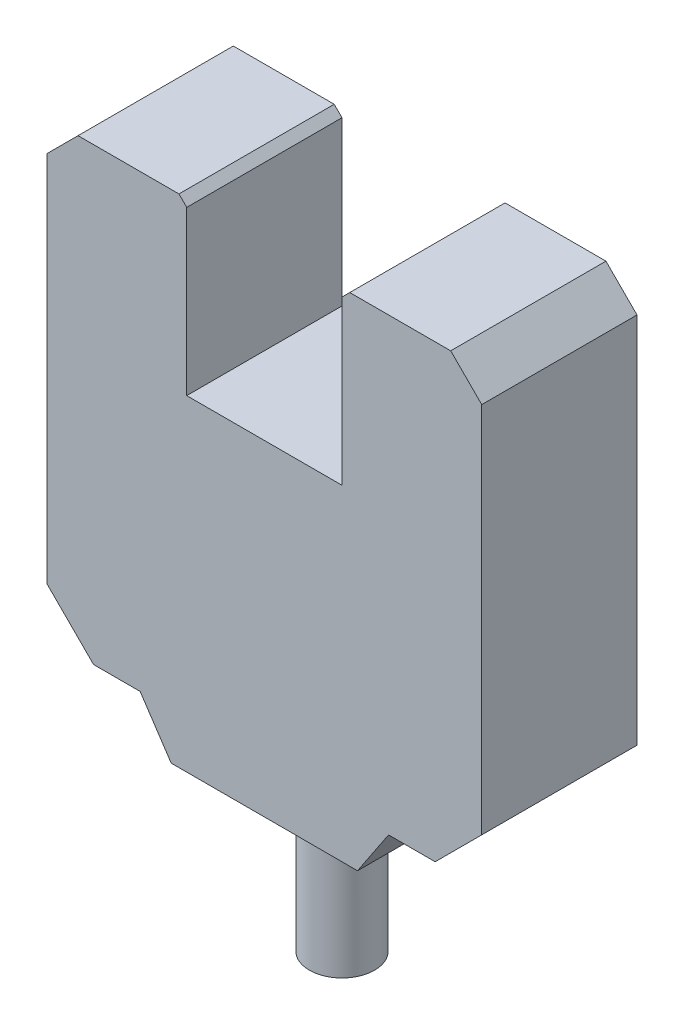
SolidWorks part; units mm, degrees
ref_plane "前视基准面" through (0, 0, 0) normal (0, 0, 1) x (1, 0, 0)
ref_plane "上视基准面" through (0, 0, 0) normal (0, 1, 0) x (1, 0, 0)
ref_plane "右视基准面" through (0, 0, 0) normal (1, 0, 0) x (0, 0, -1)
sketch "草图1" plane through (0, 0, 0) normal (0, 0, 1) x (1, 0, 0)
  line L0 (0, 6) -> (0, 30)
  line L1 (2, 32) -> (8.5, 32)
  line L2 (9, 31.5) -> (9, 21)
  line L3 (9, 21) -> (19, 21)
  line L4 (19, 21) -> (19, 31.5)
  line L5 (19.5, 32) -> (26, 32)
  line L6 (28, 30) -> (28, 6)
  line L7 (3, 3) -> (0, 6)
  line L8 (26, 32) -> (28, 30)
  line L9 (0, 30) -> (2, 32)
  line L10 (28, 6) -> (25, 3)
  line L11 (25, 3) -> (22, 3)
  line L12 (6, 3) -> (3, 3)
  line L13 (14, 0) -> (20, 0)
  line L14 (14, 0) -> (8, 0)
  line L15 (8.5, 32) -> (9, 31.5)
  line L16 (8, 0) -> (6, 3)
  line L17 (20, 0) -> (22, 3)
  line L18 (19, 31.5) -> (19.5, 32)
  point P2 (0, 32)
  point P4 (9, 32)
  point P7 (19, 32)
  point P8 (28, 32)
  point P16 (28, 3)
  point P17 (0, 3)
extrude "凸台-拉伸1" add sketch "草图1" along normal blind 10
sketch "草图2" plane through (0, 0, 0) normal (0, -1, 0) x (1, 0, 0)
  circle A0 centre (14, 5) radius 2.1
extrude "凸台-拉伸2" add sketch "草图2" along normal blind 10
